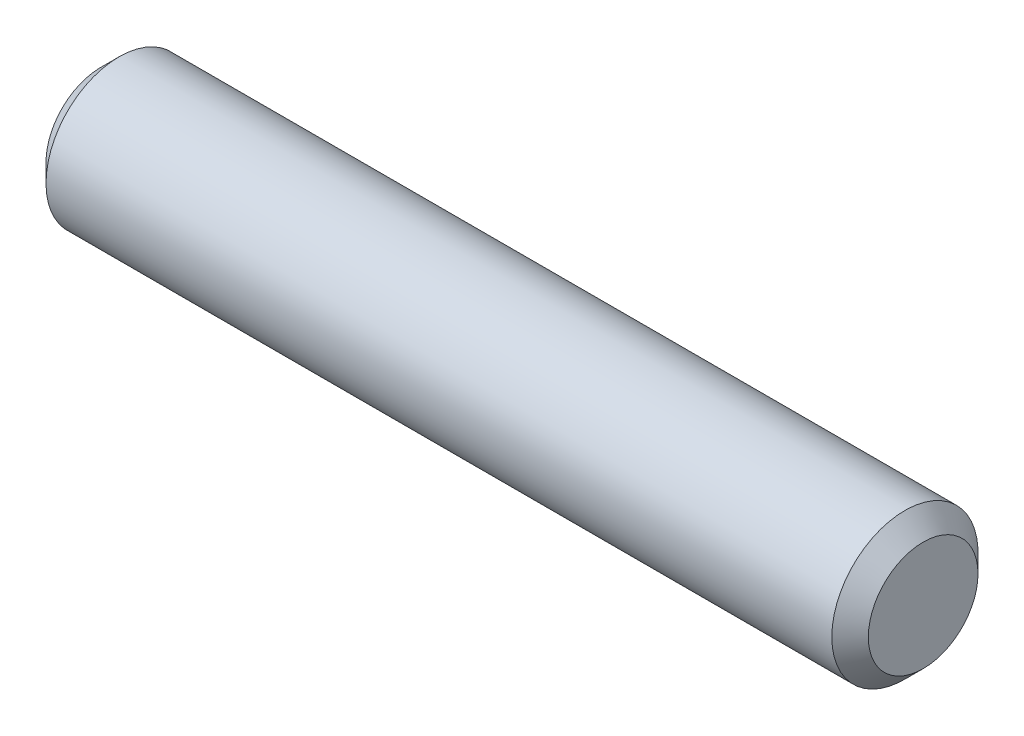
SolidWorks part; units mm, degrees
ref_plane "Front Plane" through (0, 0, 0) normal (0, 0, 1) x (1, 0, 0)
ref_plane "Top Plane" through (0, 0, 0) normal (0, 1, 0) x (1, 0, 0)
ref_plane "Right Plane" through (0, 0, 0) normal (1, 0, 0) x (0, 0, -1)
sketch "Sketch1" plane through (0, 0, 0) normal (1, 0, 0) x (0, 0, -1)
  circle A0 centre (0, 0) radius 4
  dimension "D1" = 8
extrude "Extrude1" add sketch "Sketch1" along normal blind 45
chamfer "Chamfer1" distance 1 angle 45 2 edges at (45, 0, -4) (0, 0, -4)
